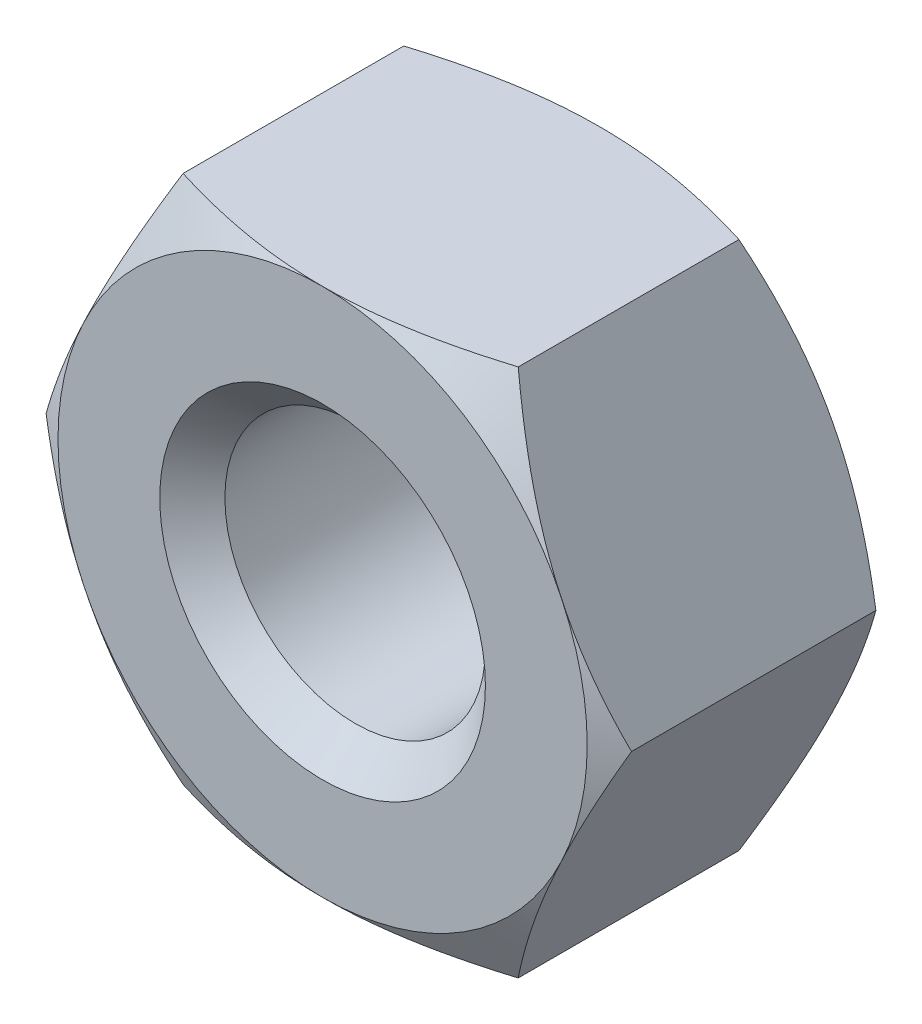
SolidWorks part; units mm, degrees
ref_plane "Plan1" through (0, 0, 0) normal (0, 0, 1) x (1, 0, 0)
ref_plane "Plan2" through (0, 0, 0) normal (0, 1, 0) x (1, 0, 0)
ref_plane "Plan3" through (0, 0, 0) normal (1, 0, 0) x (0, 0, -1)
sketch "Esquisse1" plane through (0, 0, 0) normal (0, 0, 1) x (1, 0, 0)
  line L0 (-7.19, 0) -> (-4.1165, 6.5)
  line L1 (-4.1165, 6.5) -> (4.1165, 6.5)
  line L2 (4.1165, 6.5) -> (7.19, 0)
  line L3 (7.19, 0) -> (4.1165, -6.5)
  line L4 (4.1165, -6.5) -> (-4.1165, -6.5)
  line L5 (-4.1165, -6.5) -> (-7.19, 0)
  dimension "D1" = 6.5
  dimension "D2" = 13
  dimension "D3" = 6.5
  dimension "D4" = 13
  dimension "D5" = 14.38
extrude "Base-Extrusion" add sketch "Esquisse1" along normal blind 6.8
sketch "Esquisse3" plane through (0, 0, 0) normal (1, 0, 0) x (0, 0, -1)
  line L0 (-6.8, 6.5) -> (-3.4, 12.389)
  line L1 (-3.4, 12.389) -> (0, 6.5)
  line L2 (0, 6.5) -> (2.5981, 8)
  line L3 (2.5981, 8) -> (-3.4, 18.389)
  line L4 (-6.8, 6.5) -> (-9.3981, 8)
  line L5 (-9.3981, 8) -> (-3.4, 18.389)
  line L6 (-6.8, 6.5) -> (0, 6.5) construction
  line L7 (-8.496, 0) -> (1.9245, 0) construction
  dimension "D1" = 60
  dimension "D2" = 3
revolve "Enlever de la matière-Révolution1" cut sketch "Esquisse3" angle 360 about L7
sketch "Esquisse4" plane through (0, 0, 6.8) normal (0, 0, 1) x (1, 0, 0)
  circle A0 centre (0, 0) radius 3.2
  dimension "D1" = 6.4
extrude "Enlèv. mat.-Extru.1" cut sketch "Esquisse4" against normal through all
chamfer "Chanfrein1" distance 0.8 angle 45
